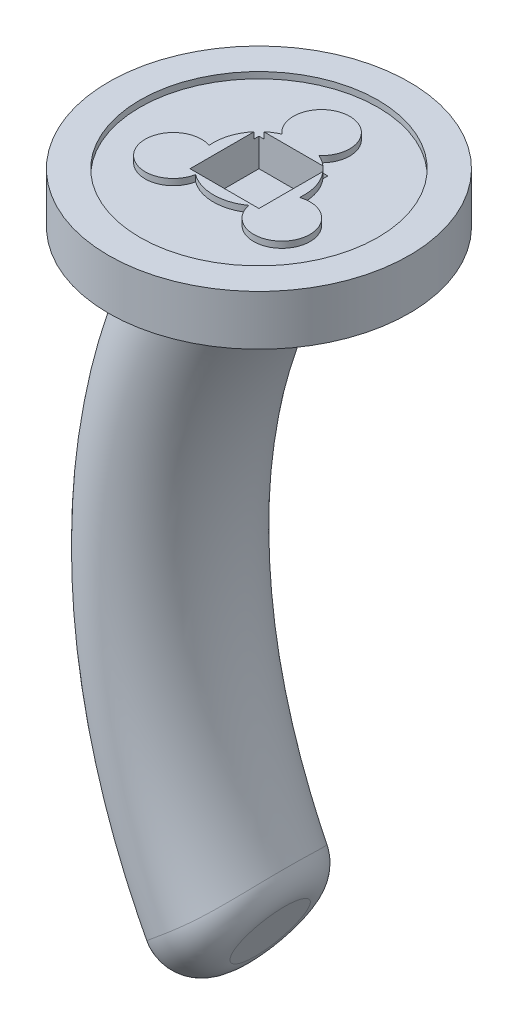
SolidWorks part; units mm, degrees
ref_plane "Front Plane" through (0, 0, 0) normal (0, 0, 1) x (1, 0, 0)
ref_plane "Top Plane" through (0, 0, 0) normal (0, 1, 0) x (1, 0, 0)
ref_plane "Right Plane" through (0, 0, 0) normal (1, 0, 0) x (0, 0, -1)
sketch "Sketch1" plane through (0, 0, 0) normal (0, 1, 0) x (1, 0, 0)
  circle A0 centre (0, 0) radius 24
  dimension "D1" = 48
extrude "Boss-Extrude1" add sketch "Sketch1" along normal blind 8
sketch "Sketch2" plane through (0, 8, 0) normal (0, 1, 0) x (1, 0, 0)
  circle A0 centre (0, 0) radius 19
  arc A1 (-2.9658, 6.6156) -> (-7.2122, -0.7393) centre (0, 0) ccw
  arc A2 (2.9658, 6.6156) -> (-2.9658, 6.6156) centre (0, 10) ccw
  arc A3 (4.2464, -5.8763) -> (7.2122, -0.7393) centre (8.6603, -5) ccw
  arc A4 (-7.2122, -0.7393) -> (-4.2464, -5.8763) centre (-8.6603, -5) ccw
  arc A5 (-4.2464, -5.8763) -> (4.2464, -5.8763) centre (0, 0) ccw
  arc A6 (7.2122, -0.7393) -> (2.9658, 6.6156) centre (0, 0) ccw
  point P13 (0, 0)
  dimension "D1" = 38
  dimension "D2" = 14.5
  dimension "D3" = 9
  dimension "D4" = 10
  dimension "D5" = 3
extrude "Cut-Extrude1" cut sketch "Sketch2" against normal blind 1
sketch "Sketch3" plane through (0, 8, 0) normal (0, 1, 0) x (1, 0, 0)
  line L0 (-5.5, 5.5) -> (5.5, 5.5)
  line L1 (5.5, 5.5) -> (5.5, -5.5)
  line L2 (5.5, -5.5) -> (-5.5, -5.5)
  line L3 (-5.5, -5.5) -> (-5.5, 5.5)
  dimension "D1" = 11
  dimension "D2" = 5.5
  dimension "D3" = 11
  dimension "D4" = 5.5
extrude "Cut-Extrude2" cut sketch "Sketch3" against normal blind 5.5
ref_plane "Plane1" through (0, -30, 0) normal (0, -1, 0) x (-1, 0, 0)
ref_plane "Plane2" through (0, -100, 0) normal (0, -1, 0) x (-1, 0, 0)
sketch "Sketch5" plane through (0, 0, 0) normal (0, -1, 0) x (1, 0, 0)
  circle A0 centre (0, 0) radius 12
  dimension "D1" = 24
sketch "Sketch6" plane through (0, -30, 0) normal (0, -1, 0) x (-1, 0, 0)
  circle A0 centre (12, 0) radius 12
  dimension "D1" = 24
  dimension "D2" = 12
sketch "Sketch7" plane through (0, -100, 0) normal (0, -1, 0) x (-1, 0, 0)
  circle A0 centre (0, 0) radius 12
sketch "Sketch8" plane through (0, 0, 0) normal (0, 0, 1) x (1, 0, 0)
  line L2 (-24, 0) -> (24, 0) construction
  line L3 (-12, -100) -> (12, -100) construction
  arc A0 (0, 0) -> (0, -100) centre (81.575, -50) ccw
sweep "Sweep1" add profiles "Sketch5" path "Sketch8"
fillet "Fillet4" radius 6 1 edges at (0, -100, -12)
